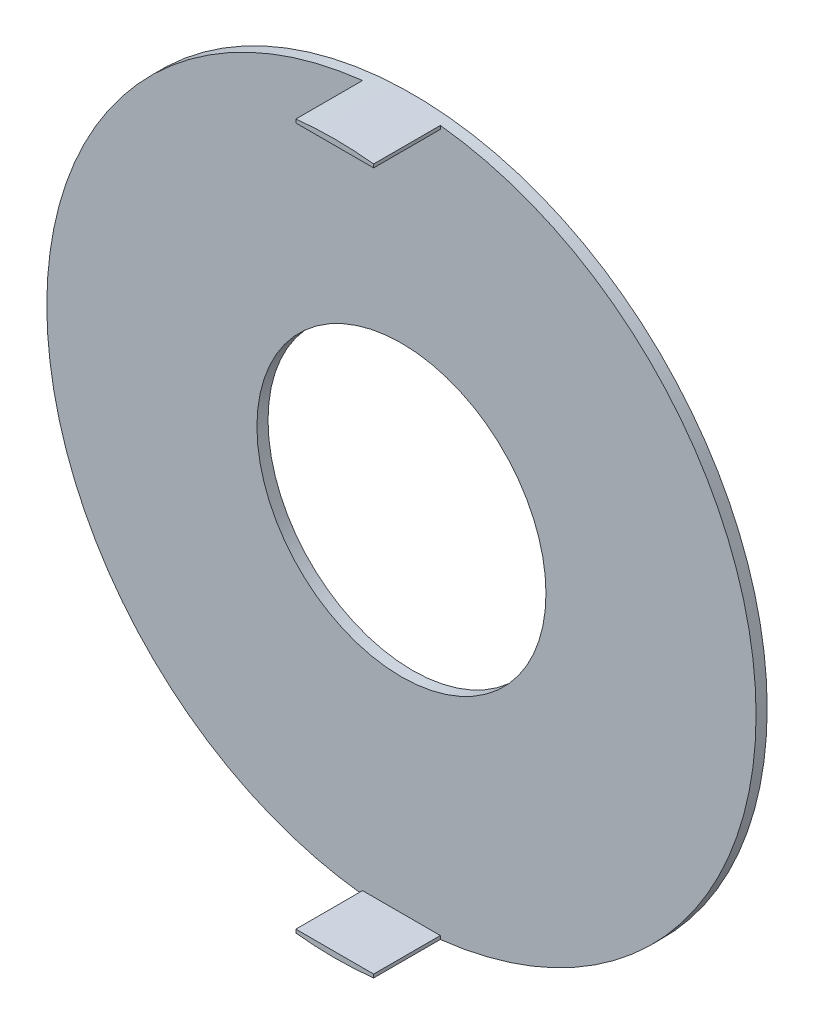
SolidWorks part; units mm, degrees
ref_plane "Plan de face" through (0, 0, 0) normal (0, 0, 1) x (1, 0, 0)
ref_plane "Plan de dessus" through (0, 0, 0) normal (0, 1, 0) x (1, 0, 0)
ref_plane "Plan de droite" through (0, 0, 0) normal (1, 0, 0) x (0, 0, -1)
sketch "Esquisse1" plane through (0, 0, 0) normal (0, 0, 1) x (1, 0, 0)
  circle A0 centre (0, 0) radius 15.95
  circle A1 centre (0, 0) radius 6.5
  dimension "D1" = 31.9
  dimension "D2" = 13
extrude "Extrusion1" add sketch "Esquisse1" along normal blind 0.5
sketch "Esquisse2" plane through (0, 0, 0.5) normal (0, 0, 1) x (1, 0, 0)
  line L0 (0, 0) -> (0, 17.6601) construction
  line L1 (-12.0424, 15.95) -> (14.9599, 15.95) construction
  line L3 (-1.75, 15.8537) -> (-1.75, 15.7)
  line L4 (-1.75, 15.7) -> (1.75, 15.7)
  line L5 (1.75, 15.8537) -> (1.75, 15.7)
  circle A0 centre (0, 0) radius 15.95 construction
  arc A1 (1.75, 15.8537) -> (-1.75, 15.8537) centre (0, 0) ccw
  dimension "D1" = 3.5
  dimension "D2" = 1.75
  dimension "D3" = 0.25
extrude "Extrusion2" add sketch "Esquisse2" along normal blind 3
pattern_circular "Répétition circulaire1" count 2 over 360 about axis through (0, 0, 0) along (0, 0, 1) of "Extrusion2"
